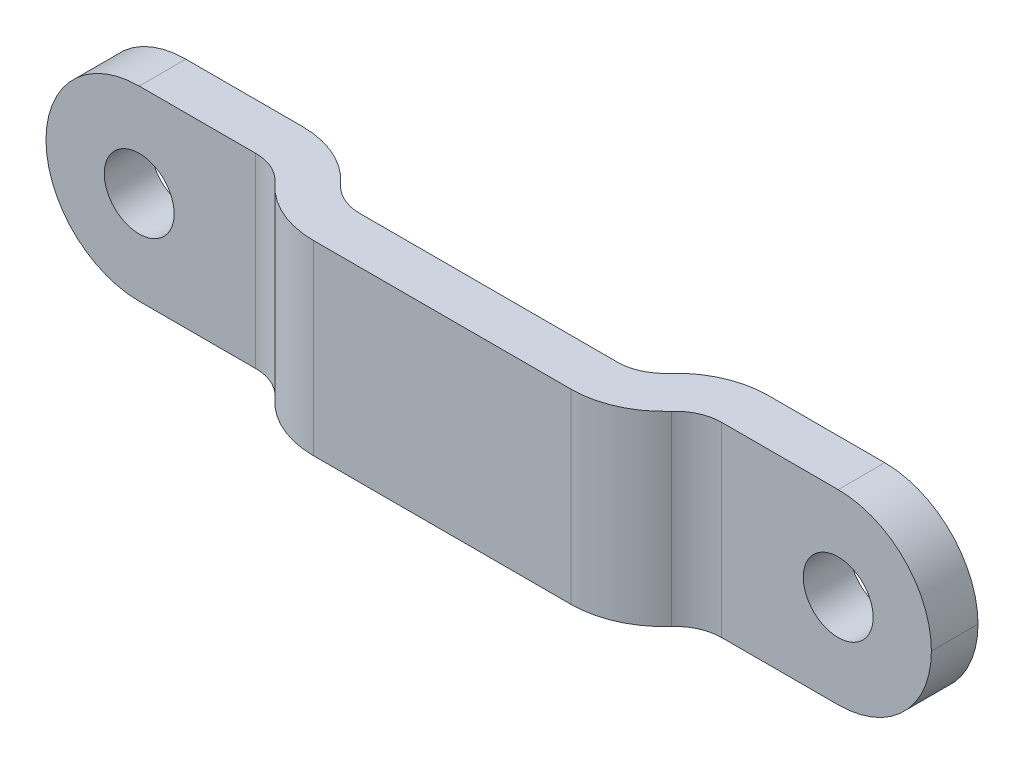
SolidWorks part; units mm, degrees
ref_plane "front" through (0, 0, 0) normal (0, 0, 1) x (1, 0, 0)
ref_plane "top" through (0, 0, 0) normal (0, 1, 0) x (1, 0, 0)
ref_plane "side" through (0, 0, 0) normal (1, 0, 0) x (0, 0, -1)
sketch "Sketch1" plane through (0, 0, 0) normal (0, 1, 0) x (1, 0, 0)
  line L0 (-30.1625, 0) -> (-15.875, 0)
  line L1 (-30.1625, 0) -> (-30.1625, -3.175)
  line L2 (-30.1625, -3.175) -> (-15.875, -3.175)
  line L3 (-8.7755, -6.35) -> (8.7755, -6.35)
  line L4 (0, 0) -> (0, 21.9313) construction
  line L5 (-8.7755, -3.175) -> (8.7755, -3.175)
  line L6 (30.1625, -3.175) -> (15.875, -3.175)
  line L7 (30.1625, 0) -> (30.1625, -3.175)
  line L8 (30.1625, 0) -> (15.875, 0)
  line L9 (-50, 0) -> (50, 0) construction
  arc A0 (-15.875, -3.175) -> (-13.5085, -4.2333) centre (-15.875, -6.35) cw
  arc A1 (-13.5085, -4.2333) -> (-8.7755, -6.35) centre (-8.7755, 0) ccw
  arc A2 (-15.875, 0) -> (-11.142, -2.1167) centre (-15.875, -6.35) cw
  arc A3 (-11.142, -2.1167) -> (-8.7755, -3.175) centre (-8.7755, 0) ccw
  arc A4 (11.142, -2.1167) -> (8.7755, -3.175) centre (8.7755, 0) cw
  arc A5 (15.875, 0) -> (11.142, -2.1167) centre (15.875, -6.35) ccw
  arc A6 (13.5085, -4.2333) -> (8.7755, -6.35) centre (8.7755, 0) cw
  arc A7 (15.875, -3.175) -> (13.5085, -4.2333) centre (15.875, -6.35) ccw
  dimension "D5" = 6.35
  dimension "D3" = 6.35
  dimension "D1" = 3.175
  dimension "D2" = 60.325
  dimension "D4" = 31.75
  dimension "D7" = 3.175
extrude "Base-Extrude" add sketch "Sketch1" along normal mid plane 12.7
fillet "Fillet1" radius 6.35 8 edges at (30.1625, -6.35, 1.5875) (-30.1625, -6.35, 1.5875) (-30.1625, 0, 0) (30.1625, 0, 0) (30.1625, 0, 3.175) (-30.1625, 0, 3.175) (30.1625, 6.35, 1.5875) (-30.1625, 6.35, 1.5875)
sketch "Sketch2" plane through (0, 0, 3.175) normal (0, 0, 1) x (1, 0, 0)
  circle A0 centre (23.8125, 0) radius 2.3813
  circle A1 centre (-23.8125, 0) radius 2.3813
  arc A2 (30.1625, 0) -> (23.8125, 6.35) centre (23.8125, 0) ccw construction
  arc A3 (-23.8125, 6.35) -> (-30.1625, 0) centre (-23.8125, 0) ccw construction
  dimension "D1" = 4.7625
extrude "Cut-Extrude1" cut sketch "Sketch2" against normal through all
